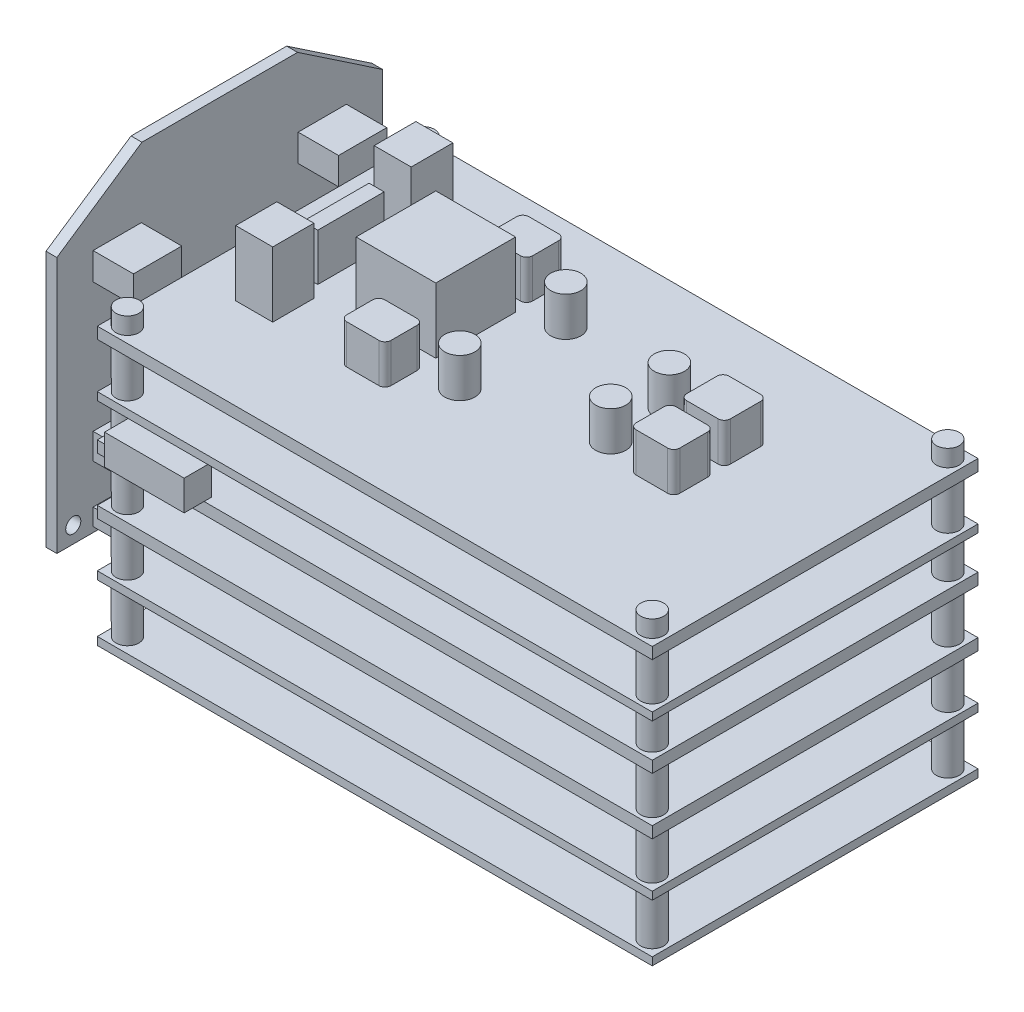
SolidWorks part; units mm, degrees
ref_plane "Front Plane" through (0, 0, 0) normal (0, 0, 1) x (1, 0, 0)
ref_plane "Top Plane" through (0, 0, 0) normal (0, 1, 0) x (1, 0, 0)
ref_plane "Right Plane" through (0, 0, 0) normal (1, 0, 0) x (0, 0, -1)
sketch "Sketch1" plane through (0, 0, 0) normal (0, 0, 1) x (1, 0, 0)
  line L0 (0, 0) -> (0, 58.2295) construction
  line L2 (-58.42, 46.2915) -> (58.42, 46.2915)
  line L3 (-58.42, 46.2915) -> (-58.42, 44.6405)
  line L4 (-58.42, 44.6405) -> (58.42, 44.6405)
  line L5 (58.42, 46.2915) -> (58.42, 44.6405)
  line L6 (-58.42, 37.4967) -> (58.42, 37.4967)
  line L7 (-58.42, 37.4967) -> (-58.42, 35.0837)
  line L8 (-58.42, 35.0837) -> (58.42, 35.0837)
  line L9 (58.42, 37.4967) -> (58.42, 35.0837)
  line L10 (-58.42, 25.5587) -> (58.42, 25.5587)
  line L11 (-58.42, 25.5587) -> (-58.42, 23.1458)
  line L12 (-58.42, 23.1458) -> (58.42, 23.1457)
  line L13 (58.42, 25.5587) -> (58.42, 23.1457)
  line L14 (-58.42, 13.6207) -> (58.42, 13.6207)
  line L15 (-58.42, 13.6207) -> (-58.42, 11.9698)
  line L16 (-58.42, 11.9698) -> (58.42, 11.9697)
  line L17 (58.42, 13.6207) -> (58.42, 11.9697)
  line L18 (-58.42, 1.651) -> (58.42, 1.651)
  line L19 (-58.42, 1.651) -> (-58.42, 0)
  line L20 (-58.42, 0) -> (58.42, 0)
  line L21 (58.42, 1.651) -> (58.42, 0)
  line L22 (-58.42, 58.2295) -> (58.42, 58.2295)
  line L23 (-58.42, 58.2295) -> (-58.42, 55.8165)
  line L24 (-58.42, 55.8165) -> (58.42, 55.8165)
  line L25 (58.42, 58.2295) -> (58.42, 55.8165)
  dimension "D1" = 2.413
  dimension "D2" = 116.84
  dimension "D3" = 2.413
  dimension "D4" = 2.413
  dimension "D5" = 1.651
  dimension "D6" = 1.651
  dimension "D7" = 1.651
  dimension "D8" = 9.525
  dimension "D9" = 9.525
  dimension "D10" = 9.525
  dimension "D11" = 10.3187
  dimension "D12" = 7.1437
extrude "Boss-Extrude1" add sketch "Sketch1" against normal blind 68.58
sketch "Sketch2" plane through (0, 58.2295, 0) normal (0, 1, 0) x (1, 0, 0)
  line L14 (55.245, 3.175) -> (55.245, 65.405)
  line L15 (-55.245, 3.175) -> (55.245, 3.175)
  line L16 (-55.245, 65.405) -> (-55.245, 3.175)
  line L17 (55.245, 65.405) -> (-55.245, 65.405)
  line L18 (55.245, 3.175) -> (55.245, 65.405) construction
  line L19 (-55.245, 3.175) -> (55.245, 3.175) construction
  line L20 (-55.245, 65.405) -> (-55.245, 3.175) construction
  line L21 (55.245, 65.405) -> (-55.245, 65.405) construction
  circle A0 centre (-55.245, 65.405) radius 2.413
  circle A1 centre (-55.245, 3.175) radius 2.413
  circle A2 centre (55.245, 3.175) radius 2.413
  circle A3 centre (55.245, 65.405) radius 2.413
  dimension "D2" = 4.826
  dimension "D1" = 3.175
extrude "Boss-Extrude2" add sketch "Sketch2" against normal blind 68.58 and the other way blind 3.556
ref_plane "Plane1" through (0, 0, -1.27) normal (0, 0, 1) x (1, 0, 0)
sketch "Sketch4" plane through (-58.42, 0, 0) normal (-1, 0, 0) x (0, 0, 1)
  line L0 (-68.58, 58.2295) -> (0, 58.2295) construction
  line L1 (-60.96, 58.2295) -> (-50.8, 58.2295)
  line L2 (-60.96, 58.2295) -> (-60.96, 63.9445)
  line L3 (-60.96, 63.9445) -> (-50.8, 63.9445)
  line L4 (-50.8, 58.2295) -> (-50.8, 63.9445)
  line L5 (-68.58, 58.2295) -> (-68.58, 55.8165) construction
  line L6 (-17.78, 58.2295) -> (-7.62, 58.2295)
  line L7 (-17.78, 58.2295) -> (-17.78, 63.9445)
  line L8 (-17.78, 63.9445) -> (-7.62, 63.9445)
  line L9 (-7.62, 58.2295) -> (-7.62, 63.9445)
  line L10 (0, 58.2295) -> (0, 55.8165) construction
  line L16 (-68.58, 13.6208) -> (0, 13.6208) construction
  line L17 (-60.96, 17.1711) -> (-7.62, 17.1711)
  line L18 (-60.96, 17.1711) -> (-60.96, 13.6208)
  line L19 (-60.96, 13.6208) -> (-7.62, 13.6208)
  line L20 (-7.62, 17.1711) -> (-7.62, 13.6208)
  line L21 (-68.58, 25.5588) -> (0, 25.5588) construction
  line L22 (-60.96, 30.9826) -> (-7.62, 30.9826)
  line L23 (-60.96, 30.9826) -> (-60.96, 25.5588)
  line L24 (-60.96, 25.5588) -> (-7.62, 25.5588)
  line L25 (-7.62, 30.9826) -> (-7.62, 25.5588)
  dimension "D1" = 10.16
  dimension "D2" = 10.16
  dimension "D3" = 7.62
  dimension "D4" = 7.62
  dimension "D5" = 5.715
extrude "Boss-Extrude4" add sketch "Sketch4" along normal blind 8.509 separate body
sketch "Sketch5" plane through (-66.929, 0, 0) normal (-1, 0, 0) x (0, 0, 1)
  line L0 (-68.58, 66.4845) -> (-50.673, 78.5495)
  line L1 (-68.58, 66.4845) -> (0, 66.4845)
  line L2 (-68.58, 66.4845) -> (-68.58, 12.5095)
  line L3 (-68.58, 12.5095) -> (0, 12.5095)
  line L4 (0, 66.4845) -> (0, 12.5095)
  line L5 (-50.673, 78.5495) -> (-17.907, 78.5495)
  line L6 (-17.907, 78.5495) -> (0, 66.4845)
  line L7 (-34.29, 1.651) -> (-34.29, 66.4845) construction
  line L8 (-68.58, 1.651) -> (0, 1.651) construction
  line L9 (-34.29, 78.5495) -> (-34.29, 66.4845) construction
  line L10 (-68.58, 58.2295) -> (0, 58.2295) construction
  dimension "D1" = 68.58
  dimension "D2" = 53.975
  dimension "D3" = 66.04
  dimension "D4" = 32.766
  dimension "D5" = 20.32
extrude "Boss-Extrude5" add sketch "Sketch5" along normal blind 2.286 contours L4 L1 L2 L3 M1 M4 M3 M2 | L6 L5 L0 L1 | M4 M1 M2 M3
sketch "Sketch6" plane through (-69.215, 0, 0) normal (-1, 0, 0) x (0, 0, 1)
  line L1 (-68.453, 50.1015) -> (-45.593, 50.1015)
  line L2 (-68.453, 50.1015) -> (-68.453, 29.4005)
  line L3 (-68.453, 29.4005) -> (-45.593, 29.4005)
  line L4 (-45.593, 50.1015) -> (-45.593, 29.4005)
  line L5 (-43.053, 50.1015) -> (-25.273, 50.1015)
  line L6 (-43.053, 50.1015) -> (-43.053, 29.4005)
  line L7 (-43.053, 29.4005) -> (-25.273, 29.4005)
  line L8 (-25.273, 50.1015) -> (-25.273, 29.4005)
  line L9 (-68.58, 12.5095) -> (0, 12.5095) construction
  line L11 (-68.58, 66.4845) -> (-68.58, 12.5095) construction
  dimension "D1" = 22.86
  dimension "D2" = 17.78
  dimension "D3" = 20.701
  dimension "D4" = 37.592
  dimension "D5" = 2.54
  dimension "D6" = 0.127
extrude "Boss-Extrude6" add sketch "Sketch6" along normal blind 5.588
sketch "Sketch7" plane through (-74.803, 0, 0) normal (-1, 0, 0) x (0, 0, 1)
  line L0 (-68.453, 50.1015) -> (-68.453, 29.4005) construction
  line L1 (-45.593, 29.4005) -> (-68.453, 29.4005)
  line L2 (-45.593, 29.4005) -> (-45.593, 34.7866)
  line L3 (-45.593, 34.7866) -> (-68.453, 34.7866)
  line L4 (-68.453, 29.4005) -> (-68.453, 34.7866)
  line L5 (-43.053, 50.1015) -> (-43.053, 29.4005) construction
  line L6 (-25.273, 29.4005) -> (-43.053, 29.4005)
  line L7 (-25.273, 29.4005) -> (-25.273, 34.7866)
  line L8 (-25.273, 34.7866) -> (-43.053, 34.7866)
  line L9 (-43.053, 29.4005) -> (-43.053, 34.7866)
extrude "Cut-Extrude1" cut sketch "Sketch7" against normal blind 1.016
sketch "Sketch8" plane through (-73.787, 0, 0) normal (-1, 0, 0) x (0, 0, 1)
  line L1 (-60.9921, 39.812) -> (-53.1462, 39.812)
  line L2 (-60.9921, 39.812) -> (-60.9921, 32.6516)
  line L3 (-60.9921, 32.6516) -> (-53.1462, 32.6516)
  line L4 (-53.1462, 39.812) -> (-53.1462, 32.6516)
  line L5 (-37.9875, 39.812) -> (-30.2938, 39.812)
  line L6 (-37.9875, 39.812) -> (-37.9875, 32.6516)
  line L7 (-37.9875, 32.6516) -> (-30.2938, 32.6516)
  line L8 (-30.2938, 39.812) -> (-30.2938, 32.6516)
extrude "Boss-Extrude7" add sketch "Sketch8" along normal blind 1.905
sketch "Sketch9" plane through (0, 29.4005, 0) normal (0, -1, 0) x (1, 0, 0)
  line L0 (-73.787, -45.593) -> (-69.215, -45.593) construction
  line L1 (-70.7257, -45.593) -> (-69.215, -45.593)
  line L2 (-70.7257, -45.593) -> (-70.7257, -68.58)
  line L3 (-70.7257, -68.58) -> (-69.215, -68.58)
  line L4 (-69.215, -45.593) -> (-69.215, -68.58)
  line L5 (-73.787, -25.273) -> (-69.215, -25.273) construction
  line L6 (-70.7257, -25.273) -> (-69.215, -25.273)
  line L7 (-70.7257, -25.273) -> (-70.7257, -43.053)
  line L8 (-70.7257, -43.053) -> (-69.215, -43.053)
  line L9 (-69.215, -25.273) -> (-69.215, -43.053)
extrude "Cut-Extrude2" cut sketch "Sketch9" against normal up to surface (5.3861 mm away)
sketch "Sketch10" plane through (0, 29.4005, 0) normal (0, -1, 0) x (1, 0, 0)
  line L0 (-72.2564, -25.273) -> (-72.2564, -68.453) construction
  line L1 (-73.787, -25.273) -> (-70.7257, -25.273) construction
  line L2 (-73.787, -68.453) -> (-70.7257, -68.453) construction
  circle A0 centre (-72.2564, -66.4487) radius 0.9722
  circle A1 centre (-72.2564, -63.9087) radius 0.9722
  circle A2 centre (-72.2564, -61.3687) radius 0.9722
  circle A3 centre (-72.2564, -58.8287) radius 0.9722
  circle A4 centre (-72.2564, -56.2887) radius 0.9722
  circle A5 centre (-72.2564, -53.7487) radius 0.9722
  circle A6 centre (-72.2564, -51.2087) radius 0.9722
  circle A7 centre (-72.2564, -48.6687) radius 0.9722
  circle A8 centre (-72.2564, -41.6526) radius 0.4638
  circle A9 centre (-72.2564, -40.0161) radius 0.431
  dimension "D1" = 8
extrude "Boss-Extrude8" add sketch "Sketch10" along normal blind 19.05
sketch "Sketch13" plane through (0, 58.2295, 0) normal (0, 1, 0) x (1, 0, 0)
  line L0 (-58.42, 50.8) -> (-58.42, 60.96) construction
  line L1 (-45.974, 44.7675) -> (-42.799, 44.7675)
  line L2 (-45.974, 44.7675) -> (-45.974, 30.7975)
  line L3 (-45.974, 30.7975) -> (-42.799, 30.7975)
  line L4 (-42.799, 44.7675) -> (-42.799, 30.7975)
  line L5 (-58.42, 34.29) -> (58.42, 34.29) construction
  line L6 (-58.42, 68.58) -> (-58.42, 0) construction
  line L7 (58.42, 68.58) -> (58.42, 0) construction
  line L9 (-48.4668, 57.1229) -> (-40.673, 57.1229)
  line L10 (-48.4668, 57.1229) -> (-48.4668, 48.339)
  line L11 (-48.4668, 48.339) -> (-40.673, 48.339)
  line L12 (-40.673, 57.1229) -> (-40.673, 48.339)
  line L13 (-48.4668, 27.8563) -> (-40.673, 27.8563)
  line L14 (-48.4668, 27.8563) -> (-48.4668, 19.1906)
  line L15 (-48.4668, 19.1906) -> (-40.673, 19.1906)
  line L16 (-40.673, 27.8563) -> (-40.673, 19.1906)
  line L17 (-33.7166, 46.5682) -> (-16.9251, 46.5682)
  line L18 (-33.7166, 46.5682) -> (-33.7166, 29.7767)
  line L19 (-33.7166, 29.7767) -> (-16.9251, 29.7767)
  line L20 (-16.9251, 46.5682) -> (-16.9251, 29.7767)
  dimension "D1" = 3.175
  dimension "D2" = 13.97
  dimension "D3" = 12.446
  dimension "D4" = 6.985
extrude "Boss-Extrude10" add sketch "Sketch13" along normal blind 13.716
sketch "Sketch14" plane through (0, 71.9455, 0) normal (0, 1, 0) x (1, 0, 0)
  line L4 (-45.974, 44.7675) -> (-45.974, 30.7975)
  line L5 (-45.974, 30.7975) -> (-42.799, 30.7975)
  line L6 (-42.799, 30.7975) -> (-42.799, 44.7675)
  line L7 (-42.799, 44.7675) -> (-45.974, 44.7675)
  line L8 (-45.974, 44.7675) -> (-45.974, 30.7975)
  line L9 (-45.974, 30.7975) -> (-42.799, 30.7975)
  line L10 (-42.799, 30.7975) -> (-42.799, 44.7675)
  line L11 (-42.799, 44.7675) -> (-45.974, 44.7675)
  dimension "D1" = 0
extrude "Cut-Extrude3" cut sketch "Sketch14" against normal blind 3.81
sketch "Sketch15" plane through (0, 58.2295, 0) normal (0, 1, 0) x (1, 0, 0)
  line L1 (-24.6975, 57.1361) -> (-18.4405, 57.1361)
  line L2 (-25.9675, 55.8661) -> (-25.9675, 50.3968)
  line L3 (-24.6975, 49.1268) -> (-18.4405, 49.1268)
  line L4 (-17.1705, 55.8661) -> (-17.1705, 50.3968)
  line L5 (-24.6975, 26.8059) -> (-17.9153, 26.8059)
  line L6 (-25.9675, 25.5359) -> (-25.9675, 20.0667)
  line L7 (-24.6975, 18.7967) -> (-17.9153, 18.7967)
  line L8 (-16.6453, 25.5359) -> (-16.6453, 20.0667)
  line L9 (25.4588, 49.1268) -> (32.1098, 49.1268)
  line L10 (24.1888, 47.8568) -> (24.1888, 41.4685)
  line L11 (25.4588, 40.1985) -> (32.1098, 40.1985)
  line L12 (33.3798, 47.8568) -> (33.3798, 41.4685)
  line L13 (25.4588, 37.9664) -> (32.1098, 37.9664)
  line L14 (24.1888, 36.6964) -> (24.1888, 30.8332)
  line L15 (25.4588, 29.5632) -> (32.1098, 29.5632)
  line L16 (33.3798, 36.6964) -> (33.3798, 30.8332)
  circle A0 centre (16.7048, 45.3191) radius 3.175
  circle A1 centre (16.7048, 32.977) radius 3.175
  circle A2 centre (-8.8986, 49.1268) radius 3.175
  circle A3 centre (-8.8986, 26.8059) radius 3.175
  arc A4 (25.4588, 49.1268) -> (24.1888, 47.8568) centre (25.4588, 47.8568) ccw
  arc A5 (32.1098, 49.1268) -> (33.3798, 47.8568) centre (32.1098, 47.8568) cw
  arc A6 (32.1098, 40.1985) -> (33.3798, 41.4685) centre (32.1098, 41.4685) ccw
  arc A7 (24.1888, 41.4685) -> (25.4588, 40.1985) centre (25.4588, 41.4685) ccw
  arc A8 (25.4588, 37.9664) -> (24.1888, 36.6964) centre (25.4588, 36.6964) ccw
  arc A9 (32.1098, 37.9664) -> (33.3798, 36.6964) centre (32.1098, 36.6964) cw
  arc A10 (32.1098, 29.5632) -> (33.3798, 30.8332) centre (32.1098, 30.8332) ccw
  arc A11 (24.1888, 30.8332) -> (25.4588, 29.5632) centre (25.4588, 30.8332) ccw
  arc A12 (-25.9675, 20.0667) -> (-24.6975, 18.7967) centre (-24.6975, 20.0667) ccw
  arc A13 (-17.9153, 18.7967) -> (-16.6453, 20.0667) centre (-17.9153, 20.0667) ccw
  arc A14 (-17.9153, 26.8059) -> (-16.6453, 25.5359) centre (-17.9153, 25.5359) cw
  arc A15 (-24.6975, 26.8059) -> (-25.9675, 25.5359) centre (-24.6975, 25.5359) ccw
  arc A16 (-25.9675, 50.3968) -> (-24.6975, 49.1268) centre (-24.6975, 50.3968) ccw
  arc A17 (-18.4405, 49.1268) -> (-17.1705, 50.3968) centre (-18.4405, 50.3968) ccw
  arc A18 (-18.4405, 57.1361) -> (-17.1705, 55.8661) centre (-18.4405, 55.8661) cw
  arc A19 (-24.6975, 57.1361) -> (-25.9675, 55.8661) centre (-24.6975, 55.8661) ccw
  dimension "D1" = 6.35
  dimension "D2" = 1.27
extrude "Boss-Extrude11" add sketch "Sketch15" along normal blind 8.255
sketch "jon_Sketch16" plane through (-69.215, 0, 0) normal (-1, 0, 0) x (0, 0, 1)
  circle A0 centre (-34.0013, 31.2312) radius 58.7375
  dimension "D1" = 117.475
sketch "Sketch16" plane through (0, 0, 0) normal (1, 0, 0) x (0, 0, -1)
  line L0 (68.58, 0) -> (0, 0) construction
  line L1 (81.3274, -0.0254) -> (-6.7893, -0.0254)
  line L2 (81.3274, -0.0254) -> (81.3274, -11.6316)
  line L3 (81.3274, -11.6316) -> (-6.7893, -11.6316)
  line L4 (-6.7893, -0.0254) -> (-6.7893, -11.6316)
  dimension "D1" = 0.0254
extrude "Jon_Cut-Extrude4" cut sketch "Sketch16" against normal through all and the other way through all
sketch "Sketch17" [suppressed] plane through (0, -6.35, 0) normal (0, -1, 0) x (1, 0, 0)
  circle A2 centre (-55.245, -65.405) radius 1.4224
  circle A3 centre (-55.245, -3.175) radius 1.4224
  circle A4 centre (55.245, -3.175) radius 1.4224
  circle A5 centre (55.245, -65.405) radius 1.4224
  dimension "D1" = 2.8448
sketch "Sketch18" plane through (0, 0, 0) normal (0, 0, 1) x (1, 0, 0)
  line L1 (-35.941, 43.8467) -> (-52.705, 43.8467)
  line L2 (-35.941, 43.8467) -> (-35.941, 37.4967)
  line L3 (-35.941, 37.4967) -> (-52.705, 37.4967)
  line L4 (-52.705, 43.8467) -> (-52.705, 37.4967)
  line L5 (58.42, 37.4967) -> (-58.42, 37.4967) construction
  line L7 (-55.245, 44.6405) -> (-55.245, 37.4967) construction
  dimension "D1" = 16.764
  dimension "D2" = 6.35
  dimension "D3" = 2.54
extrude "connector removed" add sketch "Sketch18" along normal blind 5.7785 from offset 1.5875
sketch "Sketch19" plane through (-69.215, 0, 0) normal (-1, 0, 0) x (0, 0, 1)
  line L0 (-68.58, 66.4845) -> (-68.58, 12.5095) construction
  line L1 (0, 66.4845) -> (0, 12.5095) construction
  line L2 (-68.58, 12.5095) -> (0, 12.5095) construction
  circle A0 centre (-3.4544, 15.9639) radius 1.5875
  circle A1 centre (-65.121, 15.9639) radius 1.5875
  point P4 (0, 0)
  dimension "D4" = 3.175
  dimension "D1" = 3.459
  dimension "D2" = 3.4544
  dimension "D3" = 3.4544
extrude "Cut-Extrude4" cut sketch "Sketch19" against normal up to next (2.286 mm away)
